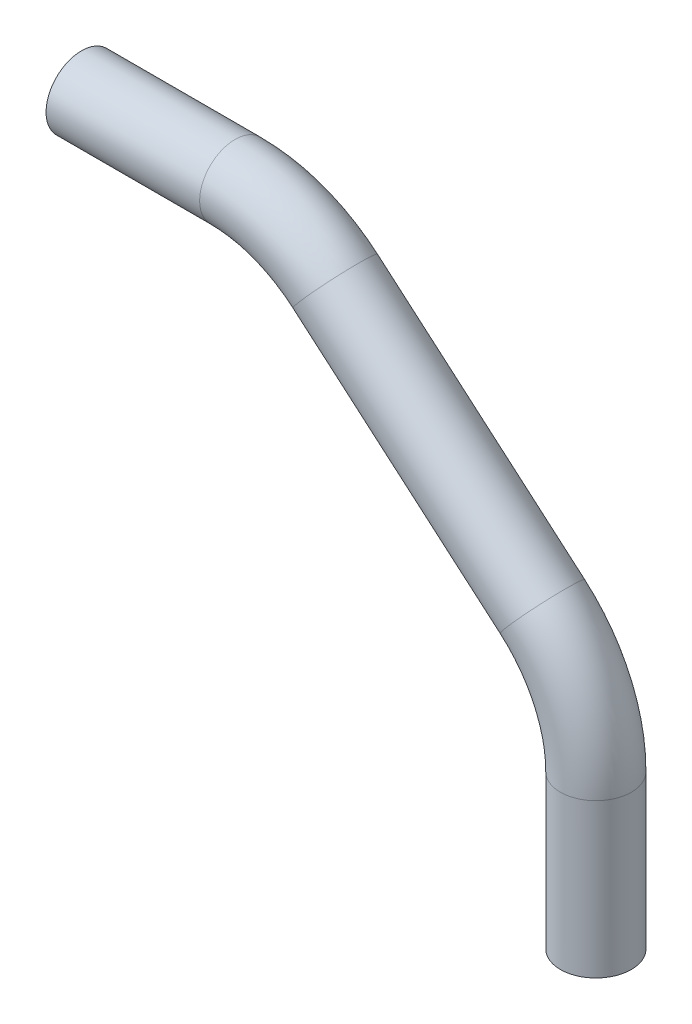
SolidWorks part; units mm, degrees
ref_plane "Front Plane" through (0, 0, 0) normal (0, 0, 1) x (1, 0, 0)
ref_plane "Top Plane" through (0, 0, 0) normal (0, 1, 0) x (1, 0, 0)
ref_plane "Right Plane" through (0, 0, 0) normal (1, 0, 0) x (0, 0, -1)
sketch "Sketch1" plane through (0, 0, 0) normal (0, 0, 1) x (1, 0, 0)
  line L0 (0, 0) -> (0, 20.6375)
  line L1 (-48.4865, 65.2262) -> (-69.124, 65.2262)
  line L3 (-57.971, 65.2262) -> (-52.63, 65.2262) construction
  line L5 (-69.124, 61.6702) -> (-69.124, 68.7822) construction
  line L6 (-35.0297, 60.2354) -> (-7.1807, 36.2843)
  arc A0 (-7.1807, 36.2843) -> (0, 20.6375) centre (-20.6375, 20.6375) cw
  arc A1 (-35.0297, 60.2354) -> (-48.4865, 65.2262) centre (-48.4865, 44.5887) ccw
  dimension "D1" = 20.6375
  dimension "D2" = 20.6375
  dimension "D3" = 139.303
  dimension "D4" = 20.6375
sketch "Sketch2" plane through (0, 0, 0) normal (0, 1, 0) x (1, 0, 0)
  circle A0 centre (0, 0) radius 4.7625
  circle A1 centre (0, 0) radius 3.8735
  dimension "D1" = 0.889
  dimension "D2" = 9.525
sweep "Sweep1" add profiles "Sketch2" path "Sketch1"
